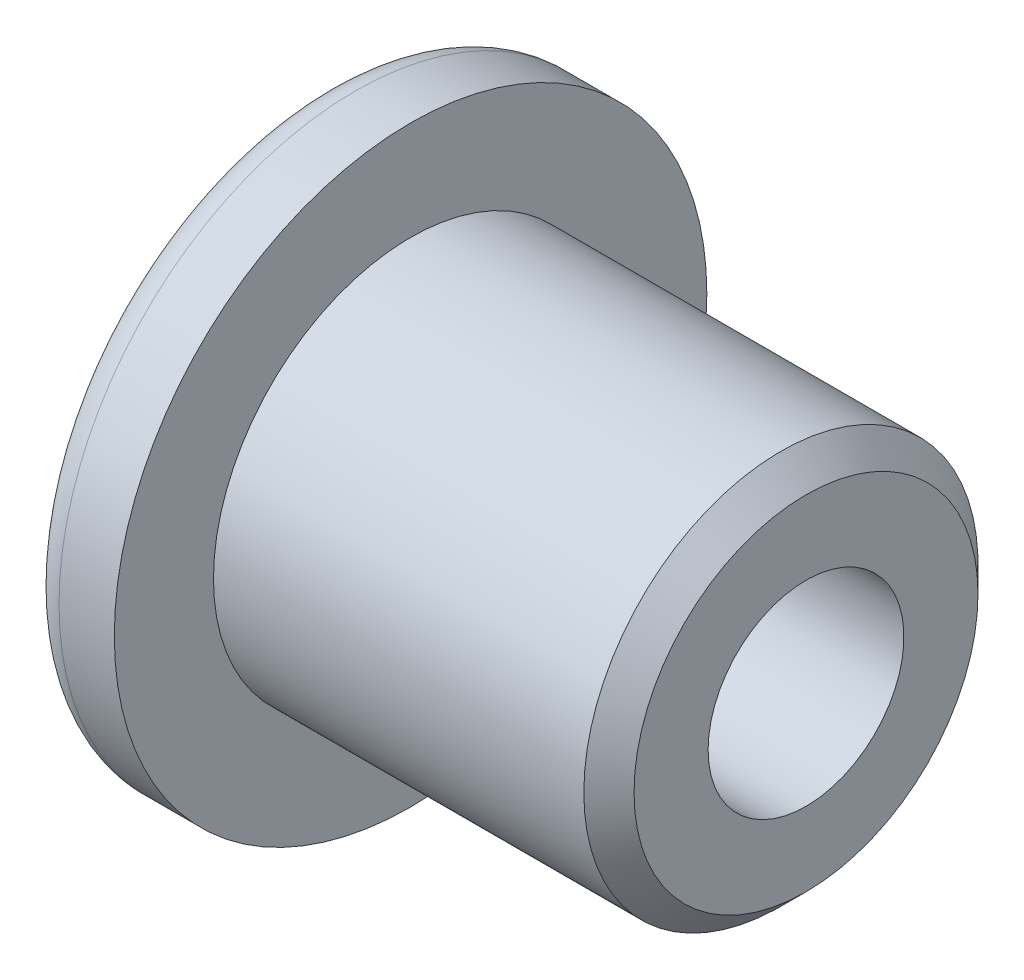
SolidWorks part; units mm, degrees
ref_plane "Front Plane" through (0, 0, 0) normal (0, 0, 1) x (1, 0, 0)
ref_plane "Top Plane" through (0, 0, 0) normal (0, 1, 0) x (1, 0, 0)
ref_plane "Right Plane" through (0, 0, 0) normal (1, 0, 0) x (0, 0, -1)
sketch "Sketch1" plane through (0, 0, 0) normal (0, 0, 1) x (1, 0, 0)
  line L0 (0, 1.9812) -> (0, 3.81)
  line L1 (0, 3.81) -> (1.016, 5.9944)
  line L2 (1.016, 5.9944) -> (2.54, 5.9944)
  line L3 (2.54, 5.9944) -> (2.54, 3.9878)
  line L4 (2.54, 3.9878) -> (10.541, 3.9878)
  line L5 (10.541, 3.9878) -> (10.541, 1.9812)
  line L6 (10.541, 1.9812) -> (0, 1.9812)
  line L7 (0, 0) -> (23.0107, 0) construction
  dimension "D1" = 3.9624
  dimension "D2" = 7.9756
  dimension "D3" = 7.62
  dimension "D4" = 11.9888
  dimension "D5" = 2.54
  dimension "D6" = 1.524
  dimension "D7" = 10.541
revolve "Revolve1" add sketch "Sketch1" angle 360 about L7
sketch "Sketch2" plane through (0, 0, 0) normal (1, 0, 0) x (0, 0, -1)
  line L1 (-1.4371, -2.4892) -> (1.4371, -2.4892)
  line L2 (1.4371, -2.4892) -> (2.8743, 0)
  line L3 (2.8743, 0) -> (1.4371, 2.4892)
  line L4 (1.4371, 2.4892) -> (-1.4371, 2.4892)
  line L5 (-1.4371, 2.4892) -> (-2.8743, 0)
  line L6 (-2.8743, 0) -> (-1.4371, -2.4892)
  circle A0 centre (0, 0) radius 2.4892 construction
  dimension "D1" = 4.9784
extrude "Cut-Extrude1" cut sketch "Sketch2" along normal blind 5.08
fillet "Fillet1" radius 0.635 1 edges at (1.016, 0, 5.9944)
chamfer "Chamfer1" distance 0.508 angle 45 1 edges at (10.541, 0, 3.9878)
